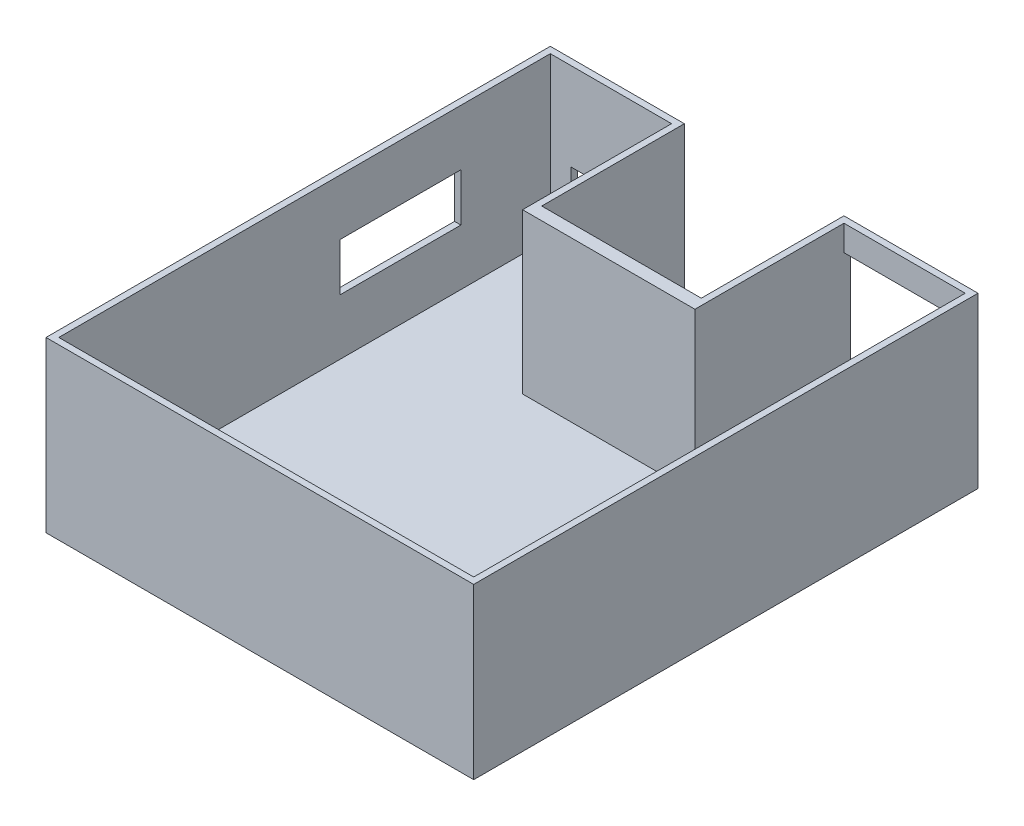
SolidWorks part; units mm, degrees
ref_plane "Front Plane" through (0, 0, 0) normal (0, 0, 1) x (1, 0, 0)
ref_plane "Top Plane" through (0, 0, 0) normal (0, 1, 0) x (1, 0, 0)
ref_plane "Right Plane" through (0, 0, 0) normal (1, 0, 0) x (0, 0, -1)
sketch "Sketch1" plane through (0, 0, 0) normal (0, 1, 0) x (1, 0, 0)
  line L1 (-65, -55) -> (65, -55)
  line L2 (-65, -55) -> (-65, 55)
  line L3 (-25, 52.3119) -> (25, 52.3119)
  line L4 (65, -55) -> (65, 55)
  line L5 (-65, -55) -> (65, 55) construction
  line L6 (-65, 55) -> (65, -55) construction
  line L8 (-65, 55) -> (-65, 101)
  line L9 (-65, 101) -> (-25, 101)
  line L10 (-25, 52.3119) -> (-25, 101)
  line L12 (65, 55) -> (65, 101)
  line L13 (65, 101) -> (25, 101)
  line L14 (25, 52.3119) -> (25, 101)
  point P0 (0, 0)
  dimension "D1" = 130
  dimension "D2" = 110
  dimension "D3" = 46
  dimension "D4" = 40
  dimension "D5" = 40
  dimension "D6" = 50
extrude "Boss-Extrude1" add sketch "Sketch1" along normal blind 3
sketch "Sketch2" plane through (0, 3, 0) normal (0, 1, 0) x (1, 0, 0)
  line L34 (-65, -55) -> (65, -55)
  line L41 (-67, 101) -> (-67, -57)
  line L42 (-67, -57) -> (67, -57)
  line L50 (-25, 101) -> (-63.3061, 101)
  line L51 (-63.3061, 101) -> (-67, 101)
  line L52 (-25, 101) -> (-25, 52.3119)
  line L53 (-25, 52.3119) -> (25, 52.3119)
  line L54 (25, 52.3119) -> (25, 101)
  line L55 (25, 101) -> (65, 101)
  line L56 (67, -57) -> (67, 101)
  line L57 (67, 101) -> (65, 101)
  line L58 (-65, 101) -> (-65, -55) construction
  line L59 (65, -55) -> (65, 101) construction
  dimension "D1" = 2
  dimension "D2" = 2
  dimension "D8" = 2
extrude "Boss-Extrude2" add sketch "Sketch2" along normal blind 50 and the other way blind 3 separate body
sketch "Sketch6" plane through (0, 3, 0) normal (0, 1, 0) x (1, 0, 0)
  line L0 (-67, 101) -> (-25, 101)
  line L1 (-25, 101) -> (-25, 52.3119)
  line L3 (25, 52.3119) -> (25, 101)
  line L4 (25, 101) -> (65, 101)
  line L5 (65, 101) -> (65, 99)
  line L6 (65, -55) -> (65, 101) construction
  line L7 (65, 99) -> (27, 99)
  line L8 (27, 99) -> (27, 52.3119)
  line L10 (-27, 52.3119) -> (-27, 99)
  line L11 (-27, 99) -> (-67, 99)
  line L13 (-67, 99) -> (-67, 101)
  line L14 (-27, 52.3119) -> (-25, 52.3119)
  line L15 (27, 52.3119) -> (25, 52.3119)
  line L16 (-67, 101) -> (-67, -57) construction
  dimension "D1" = 2
  dimension "D2" = 2
  dimension "D4" = 2
  dimension "D5" = 2
extrude "Boss-Extrude6" add sketch "Sketch6" along normal blind 50 and the other way blind 3
sketch "Sketch7" plane through (0, 3, 0) normal (0, 1, 0) x (1, 0, 0)
  line L0 (25, 101) -> (25, 52.3119) construction
  line L1 (-25, 52.3119) -> (25, 52.3119)
  line L2 (-25, 52.3119) -> (-25, 56.3119)
  line L3 (-25, 56.3119) -> (25, 56.3119)
  line L4 (25, 52.3119) -> (25, 56.3119)
  dimension "D1" = 4
extrude "Boss-Extrude8" add sketch "Sketch7" along normal blind 50 and the other way blind 3
sketch "Sketch8" plane through (0, 0, -101) normal (0, 0, -1) x (-1, 0, 0)
  line L0 (-25, 0) -> (-25, 53) construction
  line L1 (-64, 45) -> (-27, 45)
  line L2 (-64, 45) -> (-64, 3)
  line L3 (-64, 3) -> (-27, 3)
  line L4 (-27, 45) -> (-27, 3)
  line L5 (33.5, 25.5) -> (58.5, 25.5)
  line L6 (33.5, 25.5) -> (33.5, 15.5)
  line L7 (33.5, 15.5) -> (58.5, 15.5)
  line L8 (58.5, 25.5) -> (58.5, 15.5)
  line L9 (25, 53) -> (25, 0) construction
  line L12 (-67, 53) -> (-25, 53) construction
  dimension "D1" = 37
  dimension "D2" = 25
  dimension "D3" = 10
  dimension "D4" = 42
  dimension "D5" = 2
  dimension "D6" = 8.5
  dimension "D9" = 8
extrude "Cut-Extrude1" cut sketch "Sketch8" against normal blind 38
sketch "Sketch9" plane through (-67, 0, 0) normal (-1, 0, 0) x (0, 0, 1)
  line L0 (-101, 53) -> (57, 53) construction
  line L1 (-71, 35.5) -> (-33.1046, 35.5)
  line L2 (-71, 35.5) -> (-71, 20.5)
  line L3 (-71, 20.5) -> (-33.1046, 20.5)
  line L4 (-33.1046, 35.5) -> (-33.1046, 20.5)
  line L5 (-101, 0) -> (-101, 53) construction
  dimension "D1" = 15
  dimension "D2" = 17.5
  dimension "D3" = 30
extrude "Cut-Extrude2" cut sketch "Sketch9" against normal up to next contours L1 L4 L3 L2
